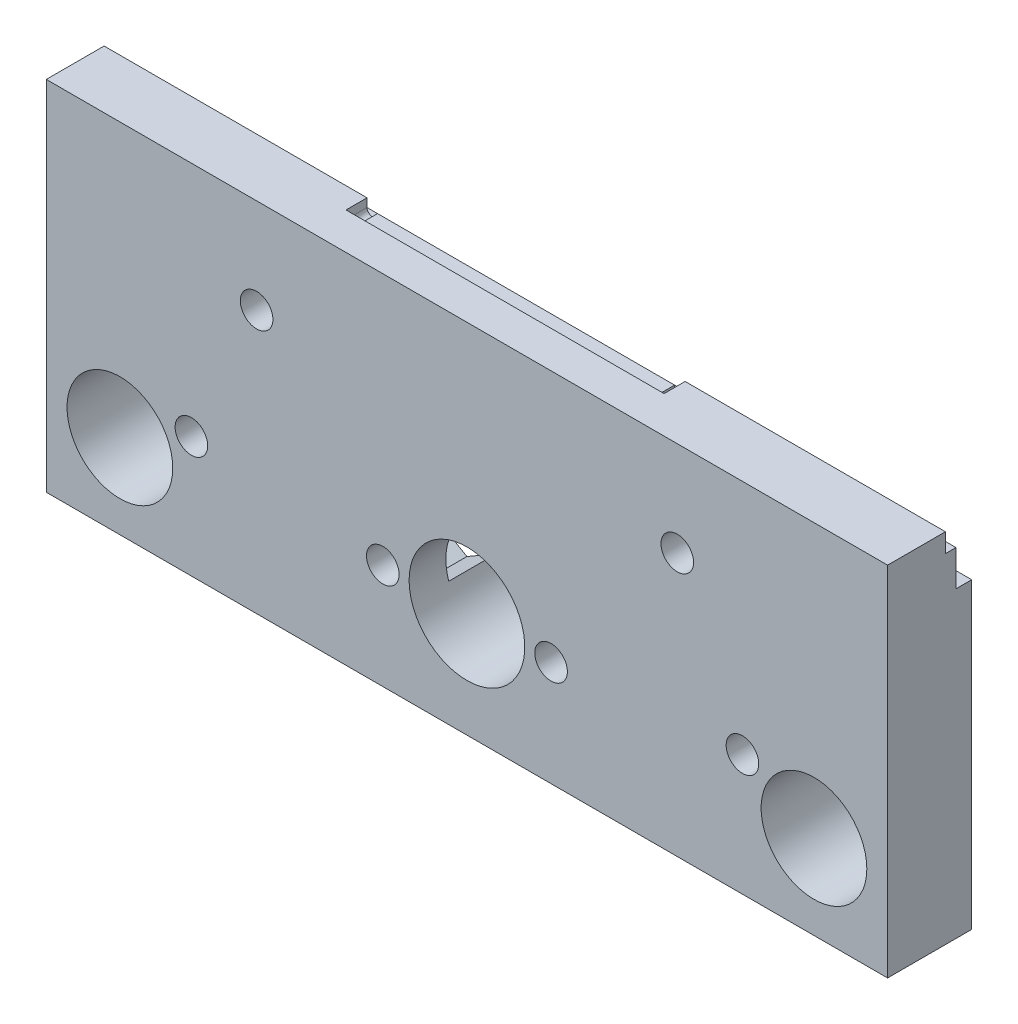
SolidWorks part; units mm, degrees
ref_plane "前视基准面" through (0, 0, 0) normal (0, 0, 1) x (1, 0, 0)
ref_plane "上视基准面" through (0, 0, 0) normal (0, 1, 0) x (1, 0, 0)
ref_plane "右视基准面" through (0, 0, 0) normal (1, 0, 0) x (0, 0, -1)
sketch "前视图草图" plane through (0, 0, 0) normal (0, 0, 1) x (1, 0, 0)
  line L0 (0, 0) -> (44.4821, 0) construction
  line L1 (0, 0) -> (0, 28.3185) construction
sketch "草图2" plane through (0, 0, 0) normal (0, 0, 1) x (1, 0, 0)
  line L0 (0, 0) -> (80, 0)
  line L1 (-200000, 0) -> (200044.4821, 0) construction
  line L2 (80, 0) -> (80, 34)
  line L3 (80, 34) -> (0, 34)
  line L4 (0, -200000) -> (0, 200028.3185) construction
  line L5 (0, 34) -> (0, 0)
  circle A0 centre (7, 8) radius 5.025
  circle A1 centre (40, 10) radius 4.05
  circle A2 centre (73, 8) radius 5.025
  dimension "D3" = 8
  dimension "D5" = 10
  dimension "D9" = 10.05
  dimension "D10" = 10.05
  dimension "D11" = 8.1
  dimension "D1" = 34
  dimension "D2" = 80
  dimension "D4" = 7
  dimension "D6" = 7
  dimension "D7" = 8
  dimension "D8" = 40
extrude "凸台-拉伸1" add sketch "草图2" along normal blind 8
sketch "草图3" plane through (0, 0, 8) normal (0, 0, 1) x (1, 0, 0)
  line L0 (16.088, 8) -> (31.4805, 8) construction
  line L1 (7, 8) -> (7, 16.8386) construction
  line L2 (73, 8) -> (73, 16.5917) construction
  line L4 (-200000, 0) -> (200044.4821, 0) construction
  circle A2 centre (23, 8) radius 2.55
  circle A3 centre (57, 8) radius 2.55
  dimension "D4" = 5.1
  dimension "D5" = 5.1
  dimension "D1" = 8
  dimension "D2" = 16
  dimension "D3" = 16
extrude "切除-拉伸1" [suppressed] cut sketch "草图3" against normal through all
sketch "草图4" plane through (80, 0, 0) normal (1, 0, 0) x (0, 0, -1)
  line L1 (0, -200000) -> (0, 200028.3185) construction
  line L2 (-1.5, 32.2) -> (-2.5, 32.2)
  line L3 (-2.5, 32.2) -> (-2.5, 34)
  line L4 (-8, 34) -> (0, 34) construction
  line L5 (-2.5, 34) -> (0, 34)
  line L6 (-1.5, 32.2) -> (-1.5, 28.8)
  line L7 (-1.5, 28.8) -> (0, 28.8)
  line L8 (0, 28.8) -> (0, 34)
  dimension "D1" = 3.4
  dimension "D2" = 2.5
  dimension "D3" = 1.5
  dimension "D4" = 1.8
extrude "切除-拉伸2" cut sketch "草图4" against normal through all
sketch "草图5" plane through (0, 0, 8) normal (0, 0, 1) x (1, 0, 0)
  line L0 (40, 10) -> (56.5376, 10) construction
  circle A0 centre (40, 10) radius 8 construction
  circle A1 centre (48, 10) radius 1.55
  circle A2 centre (32, 10) radius 1.55
  dimension "D1" = 3.1
  dimension "D2" = 3.1
  dimension "D3" = 16
extrude "切除-拉伸3" cut sketch "草图5" against normal through all
sketch "草图7" [suppressed] plane through (0, 0, 0) normal (0, 0, -1) x (-1, 0, 0)
  line L0 (-40, 12) -> (-40, -8.3696) construction
  line L1 (-23, 10) -> (-23, -2.3368) construction
  line L2 (200000, 0) -> (-200044.4821, 0) construction
  line L6 (-27.05, 10) -> (-27.05, 2.5)
  line L7 (-29.55, 0) -> (-16.45, 0)
  line L8 (-18.95, 2.5) -> (-18.95, 10)
  line L9 (-23, 8) -> (-23, 15.9045) construction
  line L13 (0, -200000) -> (0, 200028.3185) construction
  line L14 (-57, 8) -> (-57, 15.9045) construction
  line L15 (-57, 10) -> (-57, -2.3368) construction
  line L16 (-61.05, 2.5) -> (-61.05, 10)
  line L17 (-50.45, 0) -> (-63.55, 0)
  line L18 (-52.95, 10) -> (-52.95, 2.5)
  arc A1 (-18.95, 10) -> (-27.05, 10) centre (-23, 10) ccw
  arc A4 (-29.55, 0) -> (-27.05, 2.5) centre (-29.55, 2.5) ccw
  arc A5 (-18.95, 2.5) -> (-16.45, 0) centre (-16.45, 2.5) ccw
  arc A7 (-61.05, 2.5) -> (-63.55, 0) centre (-63.55, 2.5) cw
  arc A8 (-50.45, 0) -> (-52.95, 2.5) centre (-50.45, 2.5) cw
  arc A9 (-61.05, 10) -> (-52.95, 10) centre (-57, 10) cw
  dimension "D1" = 40
  dimension "D4" = 8.1
  dimension "D7" = 2.5
  dimension "D8" = 2.5
  dimension "D3" = 10
extrude "切除-拉伸4" [suppressed] cut sketch "草图7" against normal blind 6
sketch "草图8" plane through (0, 0, 0) normal (0, 0, -1) x (-1, 0, 0)
  line L0 (-40, 10) -> (-57.3165, 10) construction
  line L1 (-40, 20) -> (-40, 35.6562) construction
  line L2 (-30.5, 12.85) -> (-49.5, 12.85)
  line L3 (-49.5, 7.15) -> (-30.5, 7.15)
  line L4 (200000, 0) -> (-200044.4821, 0) construction
  line L5 (-80, 0) -> (-80, 28.8) construction
  line L6 (-45.15, 8.3546) -> (-45.15, 11.6454)
  line L7 (-45.15, 11.6454) -> (-48, 13.2909)
  line L8 (-48, 13.2909) -> (-50.85, 11.6454)
  line L9 (-50.85, 11.6454) -> (-50.85, 8.3546)
  line L10 (-50.85, 8.3546) -> (-48, 6.7091)
  line L11 (-48, 6.7091) -> (-45.15, 8.3546)
  line L12 (-34.85, 8.3546) -> (-32, 6.7091)
  line L13 (-32, 6.7091) -> (-29.15, 8.3546)
  line L14 (-29.15, 8.3546) -> (-29.15, 11.6454)
  line L15 (-29.15, 11.6454) -> (-32, 13.2909)
  line L16 (-32, 13.2909) -> (-34.85, 11.6454)
  line L17 (-34.85, 11.6454) -> (-34.85, 8.3546)
  arc A0 (-30.5, 7.15) -> (-30.5, 12.85) centre (-30.5, 10) ccw
  arc A1 (-49.5, 12.85) -> (-49.5, 7.15) centre (-49.5, 10) ccw
  circle A2 centre (-48, 10) radius 2.85 construction
  circle A3 centre (-32, 10) radius 2.85 construction
  dimension "D1" = 5.7
  dimension "D2" = 9.5
  dimension "D3" = 9.5
  dimension "D4" = 10
  dimension "D5" = 5.7
extrude "切除-拉伸5" cut sketch "草图8" against normal blind 4.5 contours L9 L10 L11 L6 L7 L8 | L17 L12 L13 L14 L15 L16
sketch "草图11" plane through (0, 0, 0) normal (0, 0, -1) x (-1, 0, 0)
  line L0 (0, 34) -> (-80, 34) construction
  line L1 (-80, 0) -> (-80, 28.8) construction
  line L2 (0, -200000) -> (0, 200028.3185) construction
  line L3 (-40, 20) -> (-40, 13.5744) construction
  line L4 (-28.772, 25) -> (-45.9396, 25) construction
  circle A0 centre (-60, 25) radius 1.55
  circle A1 centre (-20, 25) radius 1.55
  point P23 (-40, 20)
  dimension "D1" = 3.1
  dimension "D2" = 3.1
  dimension "D3" = 20
  dimension "D4" = 20
  dimension "D5" = 9
sketch "草图20" plane through (0, 0, 0) normal (0, 0, -1) x (-1, 0, 0)
  circle A0 centre (-40, 10) radius 5.5
  dimension "D1" = 11
extrude "切除-拉伸7" cut sketch "草图11" against normal through all contours A0 | A1
sketch "草图12" plane through (0, 0, 0) normal (0, 0, -1) x (-1, 0, 0)
  line L0 (-62.5, 22.15) -> (-57.5, 22.15)
  line L1 (-57.5, 27.85) -> (-62.5, 27.85)
  line L4 (-80, 0) -> (-80, 28.8) construction
  line L5 (-39.1423, 25) -> (-43.2672, 25) construction
  line L6 (-60, 21) -> (-60, 25.2385) construction
  line L7 (-20, 21) -> (-20, 26.1603) construction
  line L8 (-40, 20) -> (-40, 24.3689) construction
  line L9 (-17.5, 27.85) -> (-22.5, 27.85)
  line L10 (-22.5, 22.15) -> (-17.5, 22.15)
  line L11 (0, -200000) -> (0, 200028.3185) construction
  line L12 (0, 34) -> (-80, 34) construction
  arc A0 (-62.5, 27.85) -> (-62.5, 22.15) centre (-62.5, 25) ccw
  arc A1 (-57.5, 22.15) -> (-57.5, 27.85) centre (-57.5, 25) ccw
  arc A4 (-17.5, 22.15) -> (-17.5, 27.85) centre (-17.5, 25) ccw
  arc A5 (-22.5, 27.85) -> (-22.5, 22.15) centre (-22.5, 25) ccw
  point P16 (-38, 21)
  point P28 (-40, 25)
  dimension "D2" = 20
  dimension "D3" = 5
  dimension "D4" = 2.5
  dimension "D5" = 20
  dimension "D6" = 9
  dimension "D1" = 2
sketch "草图19" plane through (0, 0, 2.5) normal (0, 0, -1) x (-1, 0, 0)
  line L0 (0, 34) -> (-80, 34) construction
  line L1 (-25, 34) -> (-55.2479, 34)
  line L2 (-25, 34) -> (-25, 33.2)
  line L3 (-26, 33.2) -> (-54.2479, 33.2)
  line L4 (-55.2479, 34) -> (-55.2479, 33.2)
  line L5 (0, -200000) -> (0, 200028.3185) construction
  line L7 (0, 32.2) -> (-80, 32.2) construction
  line L8 (-56.3335, 32.7) -> (-52.9089, 32.7) construction
  line L9 (-55.2479, 1028.5823) -> (-55.2479, 33.2) construction
  line L10 (-25, 1028.5823) -> (-25, 32.7) construction
  line L11 (-55.2479, 32.7) -> (-55.2479, -973.3) construction
  line L12 (-25, 32.7) -> (-25, -973.3) construction
  arc A3 (-55.2479, 33.2) -> (-54.2479, 33.2) centre (-54.7479, 33.2) ccw
  arc A6 (-26, 33.2) -> (-25, 33.2) centre (-25.5, 33.2) ccw
  dimension "D3" = 1
  dimension "D4" = 1
  dimension "D2" = 0.8
  dimension "D1" = 0.5
  dimension "D9" = 25
extrude "切除-拉伸11" cut sketch "草图19" against normal blind 2
sketch "草图22" plane through (0, 0, 0) normal (0, 0, -1) x (-1, 0, 0)
  line L0 (-66.2, 0) -> (-66.2, 28.8) construction
  line L1 (200000, 0) -> (-200044.4821, 0) construction
  line L2 (0, 28.8) -> (-80, 28.8) construction
  line L3 (-80, 11.5) -> (0, 11.5) construction
  line L4 (-80, 0) -> (-80, 28.8) construction
  line L5 (0, -200000) -> (0, 200028.3185) construction
  line L7 (-40, 32.2) -> (-40, 0) construction
  line L8 (0, 32.2) -> (-80, 32.2) construction
  line L10 (-40, -199980) -> (-40, 200024.3689) construction
  circle A0 centre (-66.2, 11.5) radius 1.55
  circle A1 centre (-13.8, 11.5) radius 1.55
  dimension "D3" = 3.1
  dimension "D1" = 11.5
  dimension "D2" = 13.8
extrude "切除-拉伸13" cut sketch "草图22" against normal through all
extrude "切除-拉伸14" cut sketch "草图20" against normal through all contours A0
